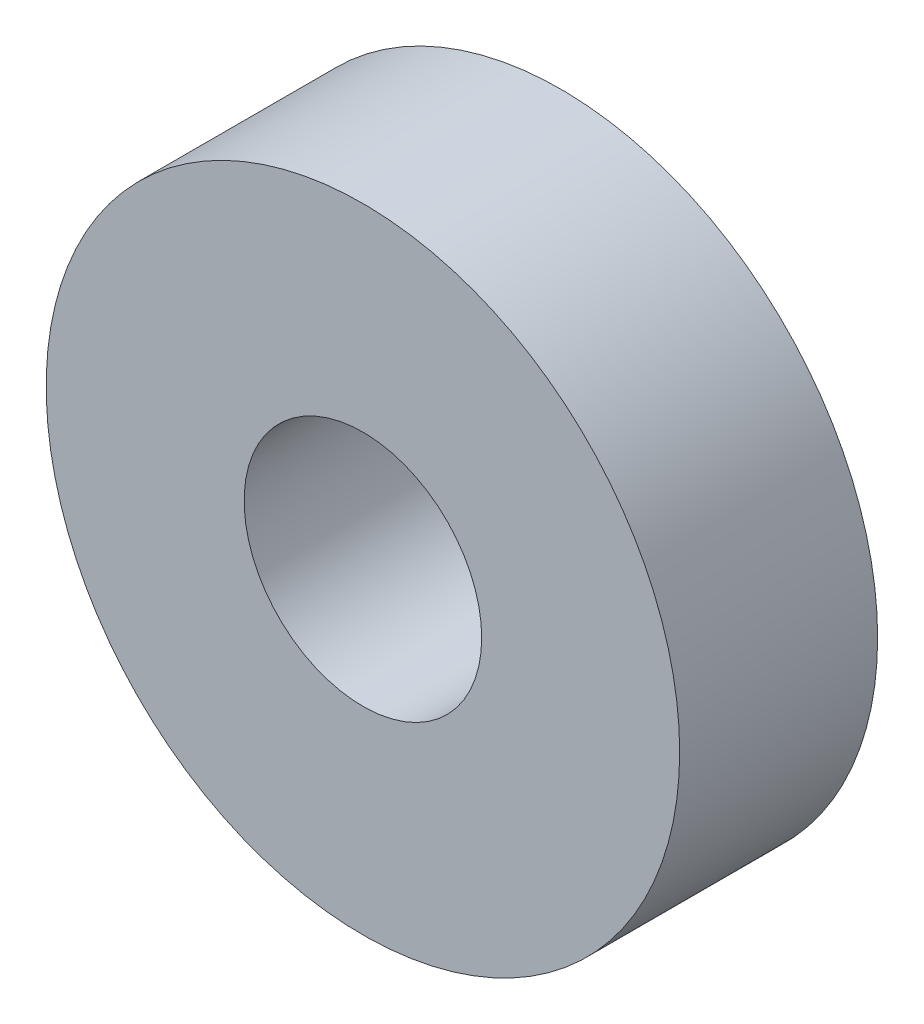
SolidWorks part; units mm, degrees
ref_plane "Plane1" through (0, 0, 0) normal (0, 0, 1) x (1, 0, 0)
ref_plane "Plane2" through (0, 0, 0) normal (0, 1, 0) x (1, 0, 0)
ref_plane "Plane3" through (0, 0, 0) normal (1, 0, 0) x (0, 0, -1)
sketch "Esquisse1" plane through (0, 0, 0) normal (0, 0, 1) x (1, 0, 0)
  circle A0 centre (0, 0) radius 8
  dimension "D1" = 16
extrude "Base-Extrusion" add sketch "Esquisse1" along normal blind 5
sketch "Esquisse2" plane through (0, 0, 5) normal (0, 0, 1) x (1, 0, 0)
  circle A0 centre (0, 0) radius 3
  dimension "D1" = 6
extrude "Enlèv. mat.-Extru.1" cut sketch "Esquisse2" against normal blind 5
